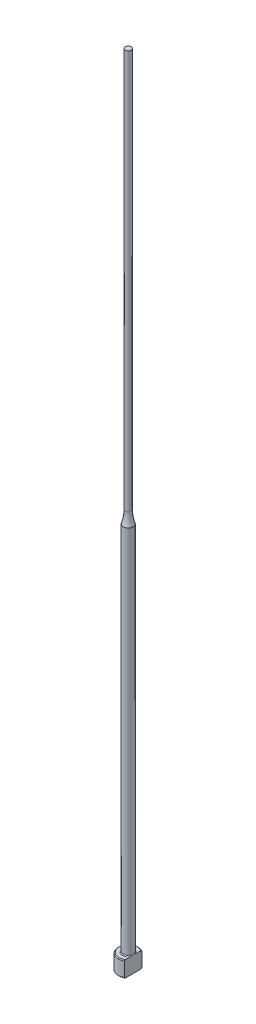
SolidWorks part; units mm, degrees
ref_plane "Front Plane" through (0, 0, 0) normal (0, 0, 1) x (1, 0, 0)
ref_plane "Top Plane" through (0, 0, 0) normal (0, 1, 0) x (1, 0, 0)
ref_plane "Right Plane" through (0, 0, 0) normal (1, 0, 0) x (0, 0, -1)
sketch "Sketch1" plane through (0, 0, 0) normal (0, 0, 1) x (1, 0, 0)
  line L0 (0, 259.9588) -> (0, -15.1925) construction
  line L1 (0, 0) -> (-2.5, 0)
  line L2 (-2.5, 0) -> (-2.5, 4)
  line L3 (-2.5, 4) -> (-1.25, 4)
  line L4 (-0.75, 100) -> (-0.75, 200)
  line L5 (-0.75, 200) -> (0, 200)
  line L6 (0, 200) -> (0, 0)
  line L7 (-1.25, 4) -> (-1.25, 96.8775)
  arc A0 (-1.25, 96.8775) -> (-0.75, 100) centre (-10.75, 100) ccw
  point P13 (-1.25, 0)
  dimension "D1" = 10
  dimension "L" = 200
  dimension "H" = 5
  dimension "T" = 4
  dimension "D" = 1.5
  dimension "B" = 2.5
  dimension "S" = 100
revolve "Revolve1" add sketch "Sketch1" angle 360 about L0
chamfer "Chamfer1" distance 0.2 angle 45 2 edges at (0, 4, 2.5) (0, 0, 2.5)
fillet "Fillet1" radius 0.2 1 edges at (0, 4, 1.25)
sketch "Sketch2" plane through (0, 0, 0) normal (0, 1, 0) x (1, 0, 0)
  line L0 (1.25, -2.1651) -> (1.25, 2.1651)
  circle A0 centre (0, 0) radius 2.5 construction
  arc A1 (1.25, -2.1651) -> (1.25, 2.1651) centre (0, 0) ccw
  circle A2 centre (0, 0) radius 1.25 construction
extrude "Keyed Head" cut sketch "Sketch2" along normal through all
